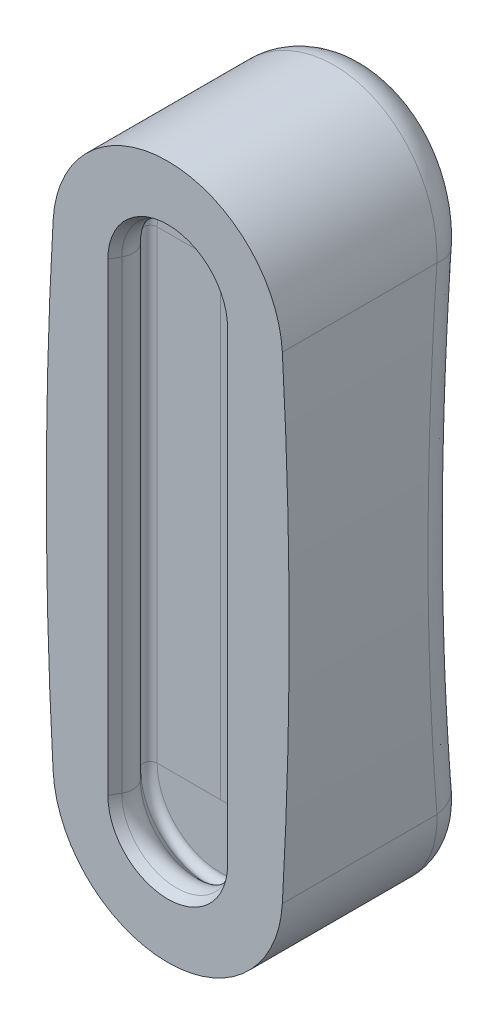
SolidWorks part; units mm, degrees
ref_plane "Front Plane" through (0, 0, 0) normal (0, 0, 1) x (1, 0, 0)
ref_plane "Top Plane" through (0, 0, 0) normal (0, 1, 0) x (1, 0, 0)
ref_plane "Right Plane" through (0, 0, 0) normal (1, 0, 0) x (0, 0, -1)
sketch "Sketch1" plane through (0, 0, 0) normal (0, 0, 1) x (1, 0, 0)
  line L1 (0, -105.9945) -> (0, 21.0055) construction
  line L2 (-22.225, -42.4945) -> (22.225, -42.4945) construction
  arc A0 (-20.9709, 1.2046) -> (20.9709, 1.2046) centre (0, 0) cw
  arc A1 (-20.9709, 1.2046) -> (-20.9709, -86.1936) centre (739.775, -42.4945) ccw
  arc A2 (-20.9709, -86.1936) -> (20.9709, -86.1936) centre (0, -84.989) ccw
  arc A3 (20.9709, 1.2046) -> (20.9709, -86.1936) centre (-739.775, -42.4945) cw
  dimension "D1" = 127
  dimension "D3" = 762
  dimension "D2" = 44.45
extrude "Boss-Extrude1" add sketch "Sketch1" along normal blind 38.1
sketch "Sketch2" plane through (0, 0, 38.1) normal (0, 0, 1) x (1, 0, 0)
  line L0 (0, 0) -> (0, -84.989) construction
  line L1 (12.827, 0) -> (12.827, -84.989)
  line L2 (-12.827, 0) -> (-12.827, -84.989)
  arc A0 (12.827, 0) -> (-12.827, 0) centre (0, 0) ccw
  arc A1 (-12.827, -84.989) -> (12.827, -84.989) centre (0, -84.989) ccw
  arc A2 (20.9709, 1.2046) -> (-20.9709, 1.2046) centre (0, 0) ccw construction
  arc A3 (-20.9709, -86.1936) -> (20.9709, -86.1936) centre (0, -84.989) ccw construction
  point P3 (0, -42.4945)
  dimension "D1" = 25.654
extrude "Cut-Extrude1" cut sketch "Sketch2" against normal blind 12.954
ref_plane "Plane1" through (0, 0, 0) normal (0, 1, 0) x (1, 0, 0)
sketch "Sketch3" plane through (0, 0, 0) normal (0, 1, 0) x (1, 0, 0)
  line L1 (-12.827, -25.146) -> (-12.827, -38.1) construction
  line L3 (-11.557, -28.4855) -> (0, -28.4855)
  line L4 (0, -28.4855) -> (0, -25.146)
  line L5 (-12.827, -25.146) -> (12.827, -25.146) construction
  line L6 (0, -25.146) -> (-19.177, -25.146)
  line L7 (-19.177, -25.146) -> (-19.177, -38.1)
  line L8 (-20.9709, -38.1) -> (20.9709, -38.1) construction
  line L9 (-19.177, -38.1) -> (-10.9573, -38.1)
  line L10 (-12.455, -30.6535) -> (-10.537, -32.5715)
  line L11 (-10.0224, -36.4808) -> (-10.9573, -38.1)
  line L12 (-20.9709, -38.1) -> (20.9709, -38.1) construction
  arc A1 (-10.0224, -36.4808) -> (-10.537, -32.5715) centre (-12.827, -34.8615) ccw
  arc A2 (-11.557, -28.4855) -> (-12.455, -30.6535) centre (-11.557, -29.7555) ccw
  point P13 (-12.827, -31.623)
  point P27 (-12.827, -38.1)
  dimension "D1" = 1.27
  dimension "D2" = 6.35
  dimension "D3" = 45
  dimension "D4" = 60
sketch "Sketch4" plane through (0, 0, 25.146) normal (0, 0, 1) x (1, 0, 0)
  line L2 (-12.827, 0) -> (-12.827, -84.989)
  line L3 (12.827, -84.989) -> (12.827, 0)
  line L4 (-12.827, 0) -> (-12.827, -84.989)
  line L5 (12.827, -84.989) -> (12.827, 0)
  arc A2 (12.827, 0) -> (-12.827, 0) centre (0, 0) ccw
  arc A3 (-12.827, -84.989) -> (12.827, -84.989) centre (0, -84.989) ccw
  arc A4 (12.827, 0) -> (-12.827, 0) centre (0, 0) ccw
  arc A5 (-12.827, -84.989) -> (12.827, -84.989) centre (0, -84.989) ccw
  dimension "D1" = 0
sweep "Sweep1" add profiles "Sketch3" path "Sketch4"
sketch "Sketch6" plane through (0, 0, 0) normal (1, 0, 0) x (0, 0, -1)
  line L0 (0, 21.0055) -> (-38.1, 21.0055) construction
  line L1 (0, 1.2046) -> (0, 21.0055) construction
  line L2 (-6.35, -42.4945) -> (0, -42.4945) construction
  line L3 (0, -86.1936) -> (0, 1.2046) construction
  line L4 (0, 21.0055) -> (0, -105.9945)
  arc A0 (0, -105.9945) -> (0, 21.0055) centre (314.325, -42.4945) cw
  dimension "D1" = 6.35
extrude "Cut-Extrude2" cut sketch "Sketch6" against normal through all both and the other way through all
fillet "Fillet1" radius 6.35 4 edges at (-3.1652, -105.7546, 0.0484) (3.1652, 20.7657, 0.0484)
